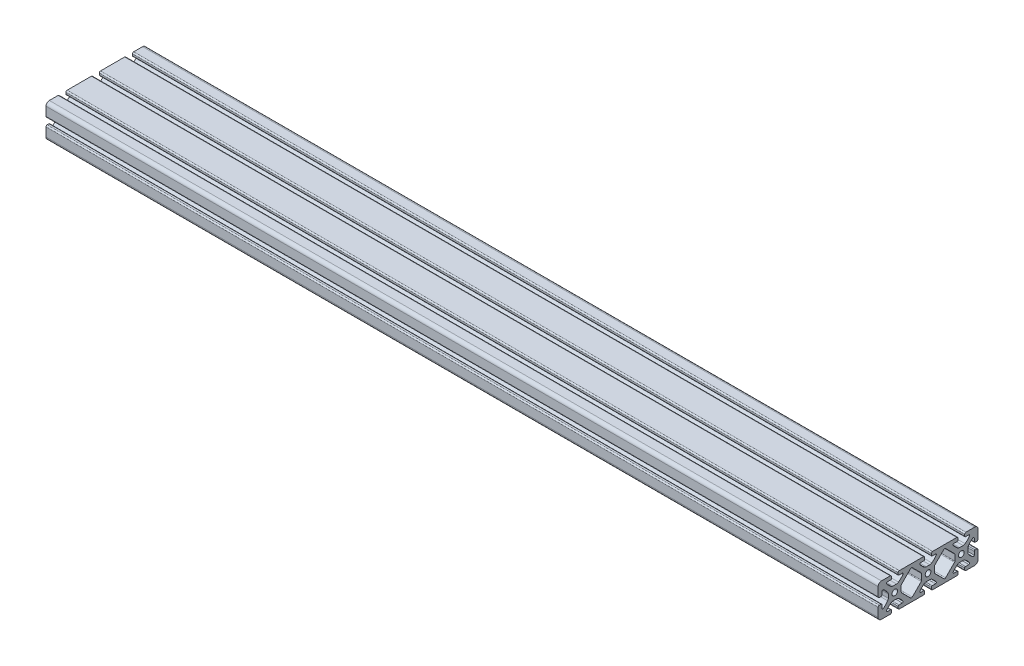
SolidWorks part; units mm, degrees
ref_plane "Ebene vorne" through (0, 0, 0) normal (0, 0, 1) x (1, 0, 0)
ref_plane "Ebene oben" through (0, 0, 0) normal (0, 1, 0) x (1, 0, 0)
ref_plane "Ebene rechts" through (0, 0, 0) normal (1, 0, 0) x (0, 0, -1)
sketch "Skizze1" plane through (0, 0, 0) normal (0, 1, 0) x (1, 0, 0)
  line L0 (0, 0) -> (1000, 0)
  dimension "D1" = 1000
other "Strukturbauteil1"
ref_plane "Ebene1" through (0, 0, 0) normal (1, 0, 0) x (0, 0, -1)
sketch "Model" plane through (0, 0, 0) normal (1, 0, 0) x (0, 0, -1)
  line L0 (-60, 16) -> (-60, 5.5)
  line L1 (-60, -5.5) -> (-60, -16)
  line L2 (-55.5, 8.964) -> (-55.5, 5)
  line L3 (-55.5, -5) -> (-55.5, -8.964)
  line L4 (-47.75, -2.1156) -> (-47.75, 2.1156)
  line L5 (-44, 18.5) -> (-44, 16.5)
  line L6 (-44, -18.5) -> (-44, -16.5)
  line L7 (-36, 18.5) -> (-36, 16.5)
  line L8 (-36, -18.5) -> (-36, -16.5)
  line L9 (-32.25, 3.4571) -> (-32.25, -3.4571)
  line L10 (-21.0607, 15.2678) -> (-31.8107, 4.5178)
  line L11 (-31.8107, -4.5178) -> (-21.0607, -15.2678)
  line L12 (-56, -20) -> (-45.5, -20)
  line L13 (-34.5, -20) -> (-5.5, -20)
  line L14 (5.5, -20) -> (34.5, -20)
  line L15 (45.5, -20) -> (56, -20)
  line L16 (-48.964, -15.5) -> (-45, -15.5)
  line L17 (-35, -15.5) -> (-31.036, -15.5)
  line L18 (-8.964, -15.5) -> (-5, -15.5)
  line L19 (5, -15.5) -> (8.964, -15.5)
  line L20 (31.036, -15.5) -> (35, -15.5)
  line L21 (45, -15.5) -> (48.964, -15.5)
  line L22 (-7.75, -3.4571) -> (-7.75, 3.4571)
  line L23 (-4, 18.5) -> (-4, 16.5)
  line L24 (-4, -18.5) -> (-4, -16.5)
  line L25 (42.1156, -7.75) -> (37.8844, -7.75)
  line L26 (2.1156, -7.75) -> (-2.1156, -7.75)
  line L27 (-37.8844, -7.75) -> (-42.1156, -7.75)
  line L28 (-58.5, -4) -> (-56.5, -4)
  line L29 (58.5, -4) -> (56.5, -4)
  line L30 (-18.9393, -15.2678) -> (-8.1893, -4.5178)
  line L31 (-8.1893, 4.5178) -> (-18.9393, 15.2678)
  line L32 (4, 18.5) -> (4, 16.5)
  line L33 (4, -18.5) -> (4, -16.5)
  line L34 (18.9393, 15.2678) -> (8.1893, 4.5178)
  line L35 (-58.5, 4) -> (-56.5, 4)
  line L36 (58.5, 4) -> (56.5, 4)
  line L37 (8.1893, -4.5178) -> (18.9393, -15.2678)
  line L38 (7.75, 3.4571) -> (7.75, -3.4571)
  line L39 (-42.1156, 7.75) -> (-37.8844, 7.75)
  line L40 (-2.1156, 7.75) -> (2.1156, 7.75)
  line L41 (37.8844, 7.75) -> (42.1156, 7.75)
  line L42 (48.964, 15.5) -> (45, 15.5)
  line L43 (35, 15.5) -> (31.036, 15.5)
  line L44 (8.964, 15.5) -> (5, 15.5)
  line L45 (-5, 15.5) -> (-8.964, 15.5)
  line L46 (-31.036, 15.5) -> (-35, 15.5)
  line L47 (-45, 15.5) -> (-48.964, 15.5)
  line L48 (56, 20) -> (45.5, 20)
  line L49 (34.5, 20) -> (5.5, 20)
  line L50 (-5.5, 20) -> (-34.5, 20)
  line L51 (-45.5, 20) -> (-56, 20)
  line L52 (21.0607, -15.2678) -> (31.8107, -4.5178)
  line L53 (31.8107, 4.5178) -> (21.0607, 15.2678)
  line L54 (32.25, -3.4571) -> (32.25, 3.4571)
  line L55 (36, 18.5) -> (36, 16.5)
  line L56 (36, -18.5) -> (36, -16.5)
  line L57 (44, 18.5) -> (44, 16.5)
  line L58 (44, -18.5) -> (44, -16.5)
  line L59 (47.75, 2.1156) -> (47.75, -2.1156)
  line L60 (55.5, -8.964) -> (55.5, -5)
  line L61 (55.5, 5) -> (55.5, 8.964)
  line L62 (60, -16) -> (60, -5.5)
  line L63 (60, 5.5) -> (60, 16)
  line L65 (60, -20) -> (-60, -20) construction
  line L66 (60, -20) -> (60, 20) construction
  line L67 (60, 20) -> (-60, 20) construction
  line L68 (-60, -20) -> (-60, 20) construction
  line L69 (0, 20) -> (0, -20) construction
  line L70 (60, 0) -> (-60, 0) construction
  arc A0 (-48.531, 4.4899) -> (-53.8507, 9.799) centre (-68.65, -10.35) ccw
  arc A1 (-44.4899, -8.531) -> (-49.799, -13.8507) centre (-29.65, -28.65) ccw
  arc A2 (-30.201, -13.8507) -> (-35.5101, -8.531) centre (-50.35, -28.65) ccw
  arc A3 (9.799, -13.8507) -> (4.4899, -8.531) centre (-10.35, -28.65) ccw
  arc A4 (-60, -16) -> (-56, -20) centre (-56, -16) ccw
  arc A5 (-2.1156, -7.75) -> (-4.4899, -8.531) centre (-2.1156, -11.75) ccw
  arc A6 (-35.5101, -8.531) -> (-37.8844, -7.75) centre (-37.8844, -11.75) ccw
  arc A7 (-42.1156, -7.75) -> (-44.4899, -8.531) centre (-42.1156, -11.75) ccw
  arc A8 (-48.531, -4.4899) -> (-47.75, -2.1156) centre (-51.75, -2.1156) ccw
  arc A9 (-21.0607, -15.2678) -> (-18.9393, -15.2678) centre (-20, -14.2071) ccw
  arc A10 (-32.25, -3.4571) -> (-31.8107, -4.5178) centre (-30.75, -3.4571) ccw
  arc A11 (-8.1893, -4.5178) -> (-7.75, -3.4571) centre (-9.25, -3.4571) ccw
  arc A12 (-5.5, -20) -> (-4, -18.5) centre (-5.5, -18.5) ccw
  arc A13 (-36, -18.5) -> (-34.5, -20) centre (-34.5, -18.5) ccw
  arc A14 (-45.5, -20) -> (-44, -18.5) centre (-45.5, -18.5) ccw
  arc A15 (-58.5, -4) -> (-60, -5.5) centre (-58.5, -5.5) ccw
  arc A16 (-55.5, -8.964) -> (-53.8507, -9.799) centre (-54.464, -8.964) ccw
  arc A17 (-49.799, -13.8507) -> (-48.964, -15.5) centre (-48.964, -14.464) ccw
  arc A18 (-31.036, -15.5) -> (-30.201, -13.8507) centre (-31.036, -14.464) ccw
  arc A19 (-9.799, -13.8507) -> (-8.964, -15.5) centre (-8.964, -14.464) ccw
  arc A20 (-4, -16.5) -> (-5, -15.5) centre (-5, -16.5) ccw
  arc A21 (-55.5, -5) -> (-56.5, -4) centre (-56.5, -5) ccw
  arc A22 (-44, -16.5) -> (-45, -15.5) centre (-45, -16.5) ccw
  arc A23 (-35, -15.5) -> (-36, -16.5) centre (-35, -16.5) ccw
  arc A24 (-53.8507, -9.799) -> (-48.531, -4.4899) centre (-68.65, 10.35) ccw
  arc A25 (-49.799, 13.8507) -> (-44.4899, 8.531) centre (-29.65, 28.65) ccw
  arc A26 (-35.5101, 8.531) -> (-30.201, 13.8507) centre (-50.35, 28.65) ccw
  arc A27 (4.4899, 8.531) -> (9.799, 13.8507) centre (-10.35, 28.65) ccw
  arc A28 (-56, 20) -> (-60, 16) centre (-56, 16) ccw
  arc A29 (-4.4899, 8.531) -> (-2.1156, 7.75) centre (-2.1156, 11.75) ccw
  arc A30 (-47.75, 2.1156) -> (-48.531, 4.4899) centre (-51.75, 2.1156) ccw
  arc A31 (-37.8844, 7.75) -> (-35.5101, 8.531) centre (-37.8844, 11.75) ccw
  arc A32 (-44.4899, 8.531) -> (-42.1156, 7.75) centre (-42.1156, 11.75) ccw
  circle A33 centre (-40, 0) radius 3.4
  arc A34 (-18.9393, 15.2678) -> (-21.0607, 15.2678) centre (-20, 14.2071) ccw
  arc A35 (-31.8107, 4.5178) -> (-32.25, 3.4571) centre (-30.75, 3.4571) ccw
  arc A36 (-7.75, 3.4571) -> (-8.1893, 4.5178) centre (-9.25, 3.4571) ccw
  arc A37 (-4, 18.5) -> (-5.5, 20) centre (-5.5, 18.5) ccw
  arc A38 (-60, 5.5) -> (-58.5, 4) centre (-58.5, 5.5) ccw
  arc A39 (-44, 18.5) -> (-45.5, 20) centre (-45.5, 18.5) ccw
  arc A40 (-34.5, 20) -> (-36, 18.5) centre (-34.5, 18.5) ccw
  arc A41 (-53.8507, 9.799) -> (-55.5, 8.964) centre (-54.464, 8.964) ccw
  arc A42 (-48.964, 15.5) -> (-49.799, 13.8507) centre (-48.964, 14.464) ccw
  arc A43 (-30.201, 13.8507) -> (-31.036, 15.5) centre (-31.036, 14.464) ccw
  arc A44 (-8.964, 15.5) -> (-9.799, 13.8507) centre (-8.964, 14.464) ccw
  arc A45 (-5, 15.5) -> (-4, 16.5) centre (-5, 16.5) ccw
  arc A46 (-56.5, 4) -> (-55.5, 5) centre (-56.5, 5) ccw
  arc A47 (-45, 15.5) -> (-44, 16.5) centre (-45, 16.5) ccw
  arc A48 (-36, 16.5) -> (-35, 15.5) centre (-35, 16.5) ccw
  arc A49 (-4.4899, -8.531) -> (-9.799, -13.8507) centre (10.35, -28.65) ccw
  arc A50 (35.5101, -8.531) -> (30.201, -13.8507) centre (50.35, -28.65) ccw
  arc A51 (49.799, -13.8507) -> (44.4899, -8.531) centre (29.65, -28.65) ccw
  arc A52 (53.8507, 9.799) -> (48.531, 4.4899) centre (68.65, -10.35) ccw
  arc A53 (56, -20) -> (60, -16) centre (56, -16) ccw
  arc A54 (4.4899, -8.531) -> (2.1156, -7.75) centre (2.1156, -11.75) ccw
  arc A55 (37.8844, -7.75) -> (35.5101, -8.531) centre (37.8844, -11.75) ccw
  arc A56 (44.4899, -8.531) -> (42.1156, -7.75) centre (42.1156, -11.75) ccw
  arc A57 (47.75, -2.1156) -> (48.531, -4.4899) centre (51.75, -2.1156) ccw
  arc A58 (18.9393, -15.2678) -> (21.0607, -15.2678) centre (20, -14.2071) ccw
  arc A59 (31.8107, -4.5178) -> (32.25, -3.4571) centre (30.75, -3.4571) ccw
  arc A60 (7.75, -3.4571) -> (8.1893, -4.5178) centre (9.25, -3.4571) ccw
  arc A61 (4, -18.5) -> (5.5, -20) centre (5.5, -18.5) ccw
  arc A62 (60, -5.5) -> (58.5, -4) centre (58.5, -5.5) ccw
  arc A63 (44, -18.5) -> (45.5, -20) centre (45.5, -18.5) ccw
  arc A64 (34.5, -20) -> (36, -18.5) centre (34.5, -18.5) ccw
  arc A65 (8.964, -15.5) -> (9.799, -13.8507) centre (8.964, -14.464) ccw
  arc A66 (30.201, -13.8507) -> (31.036, -15.5) centre (31.036, -14.464) ccw
  arc A67 (53.8507, -9.799) -> (55.5, -8.964) centre (54.464, -8.964) ccw
  arc A68 (48.964, -15.5) -> (49.799, -13.8507) centre (48.964, -14.464) ccw
  arc A69 (5, -15.5) -> (4, -16.5) centre (5, -16.5) ccw
  arc A70 (36, -16.5) -> (35, -15.5) centre (35, -16.5) ccw
  arc A71 (45, -15.5) -> (44, -16.5) centre (45, -16.5) ccw
  arc A72 (56.5, -4) -> (55.5, -5) centre (56.5, -5) ccw
  arc A73 (-9.799, 13.8507) -> (-4.4899, 8.531) centre (10.35, 28.65) ccw
  arc A74 (30.201, 13.8507) -> (35.5101, 8.531) centre (50.35, 28.65) ccw
  arc A75 (44.4899, 8.531) -> (49.799, 13.8507) centre (29.65, 28.65) ccw
  arc A76 (48.531, -4.4899) -> (53.8507, -9.799) centre (68.65, 10.35) ccw
  arc A77 (60, 16) -> (56, 20) centre (56, 16) ccw
  arc A78 (2.1156, 7.75) -> (4.4899, 8.531) centre (2.1156, 11.75) ccw
  arc A79 (48.531, 4.4899) -> (47.75, 2.1156) centre (51.75, 2.1156) ccw
  arc A80 (42.1156, 7.75) -> (44.4899, 8.531) centre (42.1156, 11.75) ccw
  arc A81 (35.5101, 8.531) -> (37.8844, 7.75) centre (37.8844, 11.75) ccw
  circle A82 centre (0, 0) radius 3.4
  circle A83 centre (40, 0) radius 3.4
  arc A84 (32.25, 3.4571) -> (31.8107, 4.5178) centre (30.75, 3.4571) ccw
  arc A85 (21.0607, 15.2678) -> (18.9393, 15.2678) centre (20, 14.2071) ccw
  arc A86 (8.1893, 4.5178) -> (7.75, 3.4571) centre (9.25, 3.4571) ccw
  arc A87 (5.5, 20) -> (4, 18.5) centre (5.5, 18.5) ccw
  arc A88 (58.5, 4) -> (60, 5.5) centre (58.5, 5.5) ccw
  arc A89 (45.5, 20) -> (44, 18.5) centre (45.5, 18.5) ccw
  arc A90 (36, 18.5) -> (34.5, 20) centre (34.5, 18.5) ccw
  arc A91 (9.799, 13.8507) -> (8.964, 15.5) centre (8.964, 14.464) ccw
  arc A92 (31.036, 15.5) -> (30.201, 13.8507) centre (31.036, 14.464) ccw
  arc A93 (49.799, 13.8507) -> (48.964, 15.5) centre (48.964, 14.464) ccw
  arc A94 (55.5, 8.964) -> (53.8507, 9.799) centre (54.464, 8.964) ccw
  arc A95 (4, 16.5) -> (5, 15.5) centre (5, 16.5) ccw
  arc A96 (35, 15.5) -> (36, 16.5) centre (35, 16.5) ccw
  arc A97 (44, 16.5) -> (45, 15.5) centre (45, 16.5) ccw
  arc A98 (55.5, 5) -> (56.5, 4) centre (56.5, 5) ccw
  point P265 (40, 20)
  point P266 (-60, 20)
  point P267 (0, 20)
  point P268 (60, 20)
  point P272 (60, -20)
  point P273 (0, -20)
  point P274 (-60, -20)
  point P275 (-60, 0)
  point P276 (60, 0)
  point P277 (40, -20)
  point P278 (-40, -20)
  point P279 (-40, 20)
  point P280 (0, 0)
  point P281 (-40, 0)
  point P282 (0, 0)
  point P283 (40, 0)
